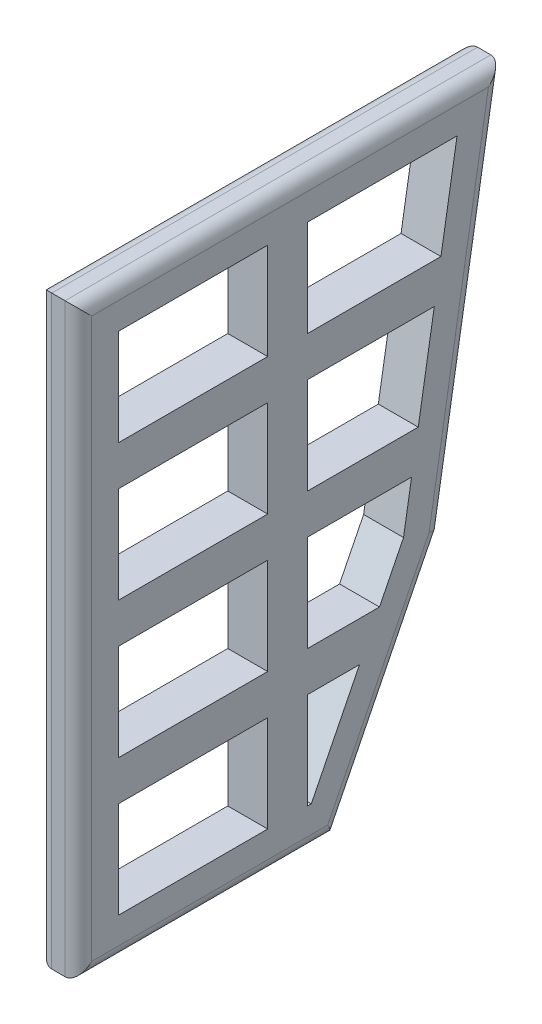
SolidWorks part; units mm, degrees
ref_plane "Front Plane" through (0, 0, 0) normal (0, 0, 1) x (1, 0, 0)
ref_plane "Top Plane" through (0, 0, 0) normal (0, 1, 0) x (1, 0, 0)
ref_plane "Right Plane" through (0, 0, 0) normal (1, 0, 0) x (0, 0, -1)
sketch "Sketch1" plane through (0, 0, 0) normal (1, 0, 0) x (0, 0, -1)
  line L0 (0, 0) -> (0, 69.85)
  line L1 (0, 69.85) -> (50.8, 69.85)
  line L2 (50.8, 69.85) -> (43.3747, 25.2869)
  line L3 (43.3747, 25.2869) -> (30.734, 0)
  line L4 (30.734, 0) -> (0, 0)
  dimension "D1" = 69.85
  dimension "D2" = 50.8
  dimension "D3" = 80.54
  dimension "D4" = 162.9
  dimension "D5" = 30.734
extrude "Boss-Extrude1" add sketch "Sketch1" along normal blind 4.7625
sketch "Sketch2" plane through (4.7625, 0, 0) normal (1, 0, 0) x (0, 0, -1)
  line L10 (4.7625, 65.0875) -> (4.7625, 4.7625)
  line L11 (45.1783, 65.0875) -> (4.7625, 65.0875)
  line L12 (38.7946, 26.776) -> (45.1783, 65.0875)
  line L13 (27.7903, 4.7625) -> (38.7946, 26.776)
  line L14 (4.7625, 4.7625) -> (27.7903, 4.7625)
  line L15 (4.7625, 65.0875) -> (4.7625, 4.7625)
  line L16 (45.1783, 65.0875) -> (4.7625, 65.0875)
  line L17 (38.7946, 26.776) -> (45.1783, 65.0875)
  line L18 (27.7903, 4.7625) -> (38.7946, 26.776)
  line L19 (4.7625, 4.7625) -> (27.7903, 4.7625)
  dimension "D1" = 4.7625
extrude "Cut-Extrude1" cut sketch "Sketch2" against normal through all both and the other way through all
fillet "Fillet1" radius 1.5875 10 edges at (0, 47.5685, -47.0873) (0, 12.6435, -37.0543) (0, 0, -15.367) (4.7625, 0, -15.367) (4.7625, 12.6435, -37.0543) (4.7625, 47.5685, -47.0873) (4.7625, 69.85, -25.4) (0, 69.85, -25.4) (0, 34.925, 0) (4.7625, 34.925, 0)
sketch "Sketch3" plane through (0, 65.0875, 0) normal (0, -1, 0) x (1, 0, 0)
  line L0 (4.7625, -4.7625) -> (4.7625, -45.1783) construction
  line L1 (4.7625, -22.5891) -> (0, -22.5891)
  line L2 (4.7625, -22.5891) -> (4.7625, -27.3516)
  line L3 (4.7625, -27.3516) -> (0, -27.3516)
  line L4 (0, -22.5891) -> (0, -27.3516)
  line L5 (0, -45.1783) -> (0, -4.7625) construction
  line L8 (4.7625, -24.9704) -> (0, -24.9704) construction
  line L9 (0, -4.7625) -> (4.7625, -4.7625) construction
  line L10 (0, -45.1783) -> (4.7625, -45.1783) construction
  dimension "D1" = 4.7625
extrude "Boss-Extrude2" add sketch "Sketch3" along normal up to surface (60.325 mm away)
sketch "Sketch4" plane through (0, 0, -4.7625) normal (0, 0, -1) x (-1, 0, 0)
  line L0 (-4.7625, 4.7625) -> (-4.7625, 65.0875) construction
  line L1 (-4.7625, 37.3062) -> (0, 37.3062)
  line L2 (-4.7625, 37.3062) -> (-4.7625, 32.5437)
  line L3 (-4.7625, 32.5437) -> (0, 32.5437)
  line L4 (0, 37.3062) -> (0, 32.5437)
  line L5 (0, 65.0875) -> (0, 4.7625) construction
  line L6 (-4.7625, 34.925) -> (0, 34.925) construction
  line L7 (0, 4.7625) -> (-4.7625, 4.7625) construction
  line L8 (0, 65.0875) -> (-4.7625, 65.0875) construction
  dimension "D1" = 4.7625
extrude "Boss-Extrude3" add sketch "Sketch4" along normal up to surface (35.7867 mm away)
sketch "Sketch5" plane through (0, 0, -4.7625) normal (0, 0, -1) x (-1, 0, 0)
  line L0 (-4.7625, 37.3062) -> (-4.7625, 65.0875) construction
  line L1 (-4.7625, 53.5781) -> (0, 53.5781)
  line L2 (-4.7625, 53.5781) -> (-4.7625, 48.8156)
  line L3 (-4.7625, 48.8156) -> (0, 48.8156)
  line L4 (0, 53.5781) -> (0, 48.8156)
  line L5 (0, 65.0875) -> (0, 37.3062) construction
  line L6 (-4.7625, 51.1969) -> (0, 51.1969) construction
  line L7 (0, 37.3062) -> (-4.7625, 37.3062) construction
  line L8 (0, 65.0875) -> (-4.7625, 65.0875) construction
  dimension "D1" = 4.7625
extrude "Boss-Extrude4" add sketch "Sketch5" along normal up to surface (38.498 mm away)
sketch "Sketch6" plane through (0, 0, -4.7625) normal (0, 0, -1) x (-1, 0, 0)
  line L0 (-4.7625, 4.7625) -> (-4.7625, 32.5437) construction
  line L1 (-4.7625, 21.0344) -> (0, 21.0344)
  line L2 (-4.7625, 21.0344) -> (-4.7625, 16.2719)
  line L3 (-4.7625, 16.2719) -> (0, 16.2719)
  line L4 (0, 21.0344) -> (0, 16.2719)
  line L5 (0, 32.5437) -> (0, 4.7625) construction
  line L6 (-4.7625, 18.6531) -> (0, 18.6531) construction
  line L7 (-4.7625, 32.5437) -> (0, 32.5437) construction
  line L8 (0, 4.7625) -> (-4.7625, 4.7625) construction
  dimension "D1" = 4.7625
extrude "Boss-Extrude5" add sketch "Sketch6" along normal up to surface (31.162 mm away)
